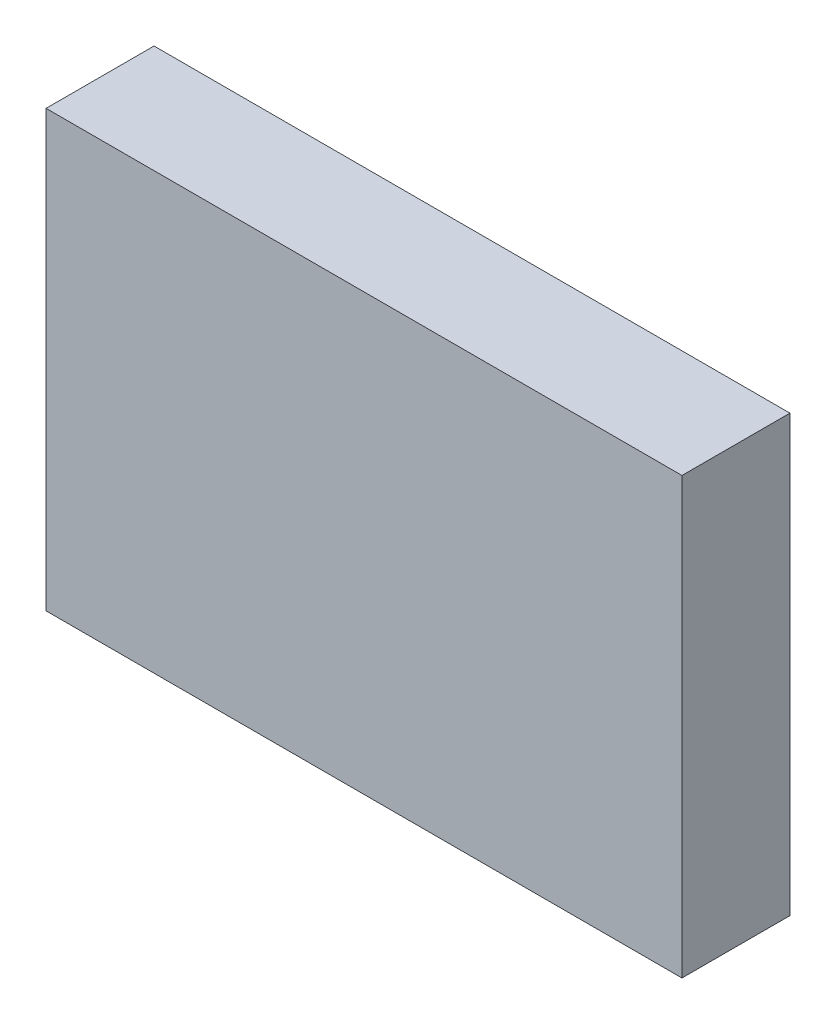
SolidWorks part; units mm, degrees
ref_plane "Front" through (0, 0, 0) normal (0, 0, 1) x (1, 0, 0)
ref_plane "Top" through (0, 0, 0) normal (0, 1, 0) x (1, 0, 0)
ref_plane "Right" through (0, 0, 0) normal (1, 0, 0) x (0, 0, -1)
sketch "Sketch1" plane through (0, 0, 0) normal (0, 0, 1) x (1, 0, 0)
  line L1 (-43.2248, 28.4433) -> (15.6774, 28.4433)
  line L2 (-43.2248, 28.4433) -> (-43.2248, -11.87)
  line L3 (-43.2248, -11.87) -> (15.6774, -11.87)
  line L4 (15.6774, 28.4433) -> (15.6774, -11.87)
extrude "Extrude1" add sketch "Sketch1" along normal blind 10
